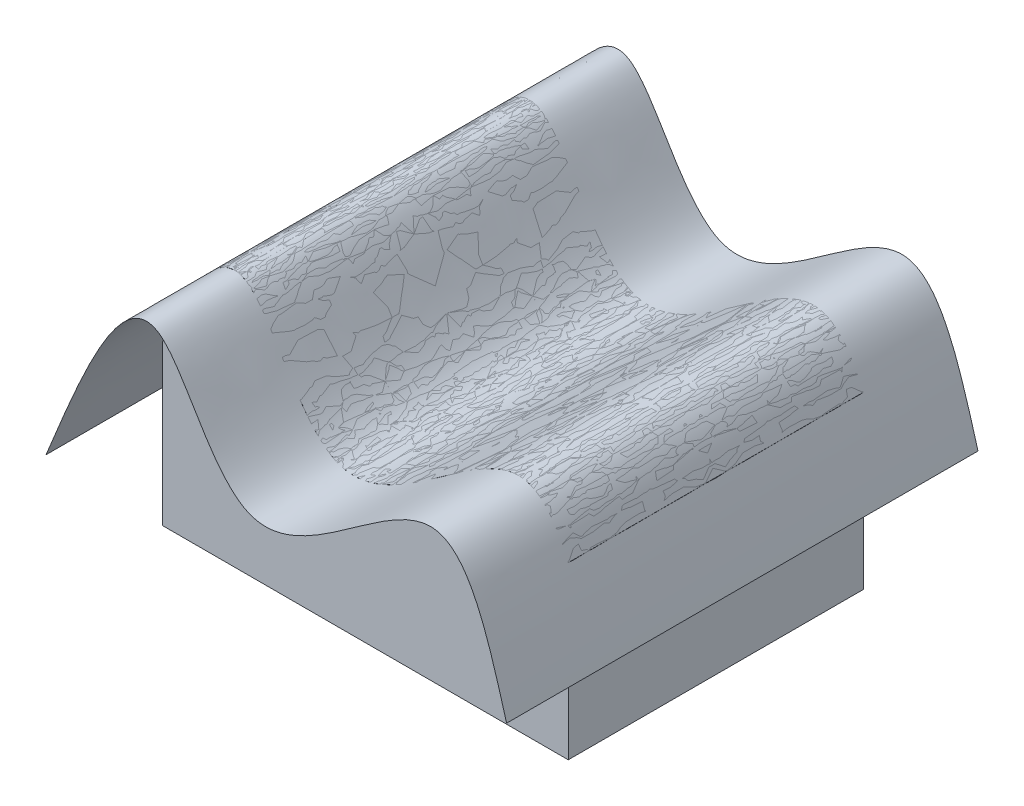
SolidWorks part; units mm, degrees
ref_plane "Front" through (0, 0, 0) normal (0, 0, 1) x (1, 0, 0)
ref_plane "Top" through (0, 0, 0) normal (0, 1, 0) x (1, 0, 0)
ref_plane "Right" through (0, 0, 0) normal (1, 0, 0) x (0, 0, -1)
sketch "Sketch1" plane through (0, 0, 0) normal (0, 0, 1) x (1, 0, 0)
  line L0 (60.6854, -29.9964) -> (-60.6854, 29.9964) construction
  line L1 (-60.6854, -29.9964) -> (60.6854, -29.9964)
  line L2 (-60.6854, -29.9964) -> (-60.6854, 29.9964)
  line L3 (-60.6854, 29.9964) -> (60.6854, 29.9964)
  line L4 (60.6854, -29.9964) -> (60.6854, 29.9964)
extrude "Extrude1" add sketch "Sketch1" along normal mid plane 88.2561
sketch "Sketch3" plane through (0, 0, 0) normal (0, 0, 1) x (1, 0, 0)
  spline_without_curve S0
surface "Surface-Extrude2" sketch "Sketch3" parameters "D1"=141.0277
other "Replace Face2"
